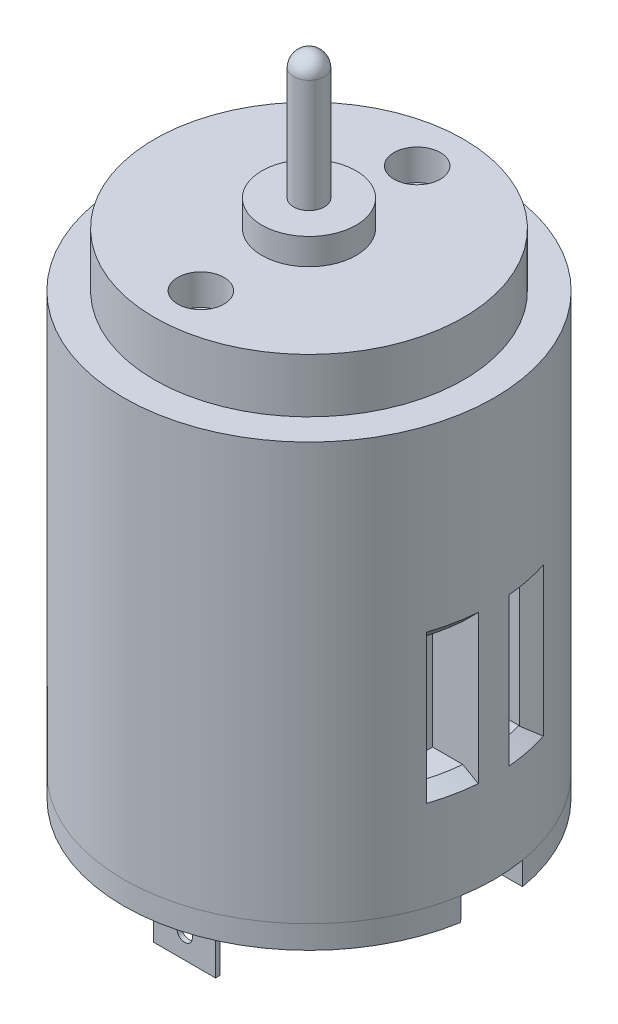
SolidWorks part; units mm, degrees
ref_plane "Front" through (0, 0, 0) normal (0, 0, 1) x (1, 0, 0)
ref_plane "Top" through (0, 0, 0) normal (0, 1, 0) x (1, 0, 0)
ref_plane "Right" through (0, 0, 0) normal (1, 0, 0) x (0, 0, -1)
sketch "Sketch1" plane through (0, 0, 0) normal (0, 1, 0) x (1, 0, 0)
  circle A0 centre (0, 0) radius 11.99
extrude "Extrude1" add sketch "Sketch1" along normal blind 1.5
sketch "Sketch2" plane through (0, 1.5, 0) normal (0, 1, 0) x (-1, 0, 0)
  circle A0 centre (0, 0) radius 12
extrude "Extrude2" add sketch "Sketch2" along normal blind 27
sketch "Sketch3" plane through (0, 28.5, 0) normal (0, 1, 0) x (-1, 0, 0)
  circle A0 centre (0, 0) radius 10
extrude "Extrude3" add sketch "Sketch3" along normal blind 3.5
sketch "Sketch4" plane through (0, 32, 0) normal (0, 1, 0) x (-1, 0, 0)
  circle A0 centre (0, 0) radius 3.05
extrude "Extrude4" add sketch "Sketch4" along normal blind 1.7
sketch "Sketch5" plane through (0, 33.7, 0) normal (0, 1, 0) x (-1, 0, 0)
  circle A0 centre (0, 0) radius 1
extrude "Extrude5" add sketch "Sketch5" along normal blind 8.3
sketch "Sketch6" plane through (0, 0, 0) normal (0, -1, 0) x (1, 0, 0)
  circle A0 centre (0, 0) radius 3.1
extrude "Extrude6" add sketch "Sketch6" along normal blind 3
sketch "Sketch7" plane through (0, -3, 0) normal (0, -1, 0) x (1, 0, 0)
  circle A0 centre (0, 0) radius 1.25
extrude "Cut-Extrude1" cut sketch "Sketch7" against normal blind 3
sketch "Sketch8" plane through (0, 0, 0) normal (0, -1, 0) x (1, 0, 0)
  circle A0 centre (0, 0) radius 1
extrude "Extrude7" add sketch "Sketch8" along normal blind 3
fillet "Fillet1" radius 1 1 edges at (0, -3, -1)
fillet "Fillet2" radius 1 1 edges at (0, 42, 1)
chamfer "Chamfer1" distance 1 1 edges at (0, -3, -3.1)
sketch "Sketch9" plane through (0, 32, 0) normal (0, 1, 0) x (-1, 0, 0)
  line L0 (5.4222, 0) -> (-6.7708, 0) construction
  circle A1 centre (0, 7) radius 1.5
  circle A2 centre (0, -7) radius 1.5
  dimension "D1" = 7
  dimension "D2" = 7
extrude "Cut-Extrude2" cut sketch "Sketch9" against normal blind 2
sketch "Sketch10" plane through (0, 0, 0) normal (0, -1, 0) x (1, 0, 0)
  line L0 (0, 8.05) -> (5.1913, 8.05) construction
  line L1 (0, 7.75) -> (2, 7.75)
  line L2 (0, 7.75) -> (-2, 7.75)
  line L3 (0, -7.75) -> (2, -7.75)
  line L4 (0, -7.75) -> (-2, -7.75)
  line L5 (0, 8.05) -> (2, 8.05)
  line L6 (0, 8.05) -> (-2, 8.05)
  line L7 (0, -8.05) -> (-2, -8.05)
  line L8 (0, -8.05) -> (2, -8.05)
  line L9 (-2, 8.05) -> (-2, 7.75)
  line L10 (2, 8.05) -> (2, 7.75)
  line L11 (0, 7.75) -> (5.1913, 7.75) construction
  line L12 (0, -7.75) -> (6.3555, -7.75) construction
  line L13 (0, -8.05) -> (6.3555, -8.05) construction
  line L14 (0, -8.05) -> (-6.074, -8.05) construction
  line L15 (0, -7.75) -> (-6.074, -7.75) construction
  line L16 (-2, -7.75) -> (-2, -8.05)
  line L17 (2, -7.75) -> (2, -8.05)
  line L18 (0, 8.05) -> (-5.5563, 8.05) construction
  line L19 (0, 7.75) -> (-5.5563, 7.75) construction
extrude "Extrude8" add sketch "Sketch10" along normal blind 5
sketch "Sketch11" plane through (0, 0, -8.05) normal (0, 0, -1) x (-1, 0, 0)
  line L5 (-0.5, -1.5) -> (-0.5, -3.5)
  line L6 (0.5, -3.5) -> (0.5, -1.5)
  arc A0 (0.5, -1.5) -> (-0.5, -1.5) centre (0, -1.5) ccw
  arc A1 (-0.5, -3.5) -> (0.5, -3.5) centre (0, -3.5) ccw
extrude "Cut-Extrude3" cut sketch "Sketch11" against normal blind 1
sketch "Sketch12" plane through (0, 0, 8.05) normal (0, 0, 1) x (1, 0, 0)
  line L0 (-0.5, -3.5) -> (-0.5, -1.5)
  line L3 (0.5, -1.5) -> (0.5, -3.5)
  arc A0 (-0.5, -3.5) -> (0.5, -3.5) centre (0, -3.5) ccw
  arc A1 (0.5, -1.5) -> (-0.5, -1.5) centre (0, -1.5) ccw
extrude "Cut-Extrude4" cut sketch "Sketch12" against normal blind 1
sketch "Sketch13" plane through (0, 0, 0) normal (1, 0, 0) x (0, 0, -1)
  line L0 (-3, 15.9442) -> (-1, 15.9442)
  line L1 (3, 7.9232) -> (1, 7.9232)
  line L2 (-3, 25) -> (-3, 0) construction
  line L4 (-1, 15.9442) -> (-1, 7.9232)
  line L5 (1, 15.9442) -> (1, 7.9232)
  line L6 (-3, 15.9442) -> (-3, 7.9232)
  line L7 (3, 15.9442) -> (3, 7.9232)
  line L8 (-1, 25) -> (-1, 0) construction
  line L9 (1, 25) -> (1, 0) construction
  line L10 (3, 25) -> (3, 0) construction
  line L11 (1, 15.9442) -> (3, 15.9442)
  line L12 (-1, 7.9232) -> (-3, 7.9232)
extrude "Cut-Extrude5" cut sketch "Sketch13" against normal mid plane 31
sketch "Sketch14" plane through (0, 0, 0) normal (1, 0, 0) x (0, 0, -1)
  line L1 (-4.525, 17.244) -> (4.7696, 17.244)
  line L2 (-4.525, 17.244) -> (-4.525, 6.7264)
  line L3 (-4.525, 6.7264) -> (4.7696, 6.7264)
  line L4 (4.7696, 17.244) -> (4.7696, 6.7264)
extrude "Extrude9" add sketch "Sketch14" along normal mid plane 18
chamfer "Chamfer2" distance 1 angle 45 2 edges at (11.8309, 15.9442, 2.0072) (11.8309, 15.9442, -2.0072)
chamfer "Chamfer3" distance 1 angle 45 2 edges at (-11.8309, 15.9442, -2.0072) (-11.8309, 15.9442, 2.0072)
chamfer "Chamfer4" distance 1 angle 30 2 edges at (-11.8309, 7.9232, -2.0072) (-11.8309, 7.9232, 2.0072)
chamfer "Chamfer5" distance 1 angle 30 2 edges at (11.8309, 7.9232, 2.0072) (11.8309, 7.9232, -2.0072)
chamfer "Chamfer6" distance 1 angle 45 2 edges at (11.619, 12.145, 3) (11.619, 12.145, -3)
chamfer "Chamfer7" distance 1 angle 45 2 edges at (-11.619, 12.145, -3) (-11.619, 12.145, 3)
sketch "Sketch15" plane through (0, 0, 0) normal (0, -1, 0) x (1, 0, 0)
  line L1 (-8.01, 2) -> (-17.5837, 2)
  line L2 (-8.01, -2) -> (-19.2932, -2)
  line L3 (8.01, 2) -> (16.9737, 2)
  line L4 (8.01, -2) -> (18.3307, -2)
  line L5 (18.3307, -2) -> (16.9737, 2)
  line L6 (-19.2932, -2) -> (-17.5837, 2)
  arc A3 (-8.01, -2) -> (-8.01, 2) centre (-8.01, 0) ccw
  arc A4 (8.01, 2) -> (8.01, -2) centre (8.01, 0) ccw
extrude "Cut-Extrude6" cut sketch "Sketch15" against normal blind 1.5
